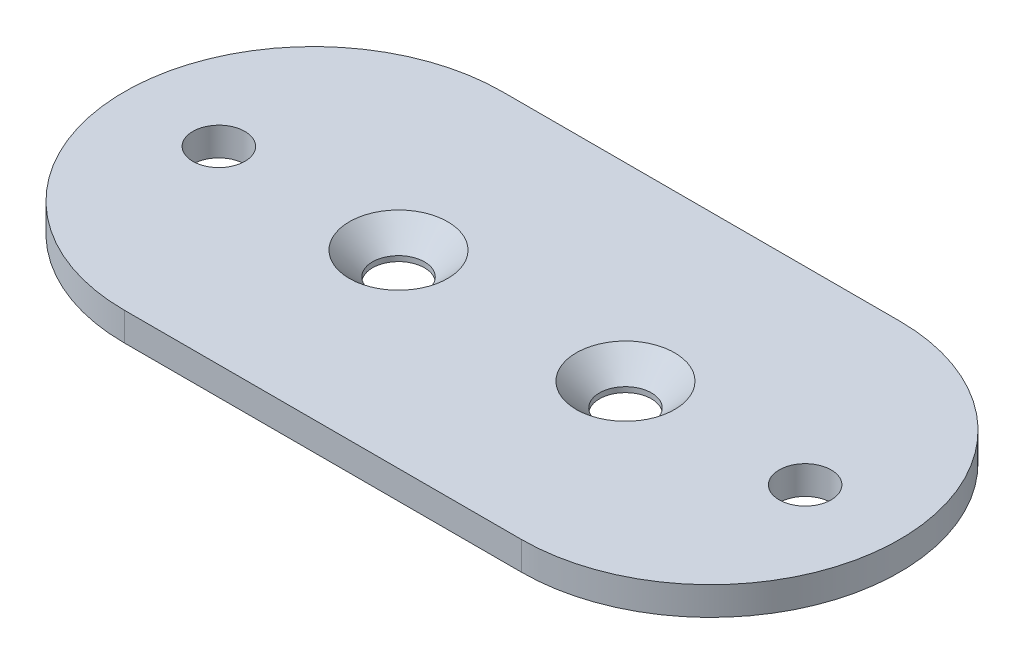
SolidWorks part; units mm, degrees
ref_plane "Front Plane" through (0, 0, 0) normal (0, 0, 1) x (1, 0, 0)
ref_plane "Top Plane" through (0, 0, 0) normal (0, 1, 0) x (1, 0, 0)
ref_plane "Right Plane" through (0, 0, 0) normal (1, 0, 0) x (0, 0, -1)
sketch "Sketch1" plane through (0, 0, 0) normal (0, 1, 0) x (1, 0, 0)
  line L0 (0, 0) -> (42, 0) construction
  line L1 (0, 20) -> (42, 20)
  line L2 (0, -20) -> (42, -20)
  line L3 (0, 0) -> (-10, 0) construction
  line L4 (42, 0) -> (52, 0) construction
  line L5 (21, 20) -> (21, -20) construction
  arc A0 (0, 20) -> (0, -20) centre (0, 0) ccw
  arc A1 (42, -20) -> (42, 20) centre (42, 0) ccw
  circle A2 centre (-10, 0) radius 2.75
  circle A3 centre (52, 0) radius 2.75
  dimension "D1" = 40
  dimension "D3" = 5.5
  dimension "D4" = 31
  dimension "D5" = 31
  dimension "D2" = 42
extrude "Boss-Extrude1" add sketch "Sketch1" along normal blind 3
sketch "Sketch2" plane through (0, 3, 0) normal (0, 1, 0) x (1, 0, 0)
  line L0 (0, 0) -> (49.25, 0) construction
  line L1 (21, 20) -> (21, -20) construction
  line L2 (42, 20) -> (0, 20) construction
  line L3 (0, -20) -> (42, -20) construction
  circle A0 centre (52, 0) radius 2.75 construction
  point P6 (9, 0)
  point P7 (33, 0)
  dimension "D1" = 24
  dimension "D2" = 12
hole_wizard "CSK for M5 Countersunk Flat Head Screw1" positions "3DSketch1" profile "Sketch3" countersink size "M5" standard "ISO"
sketch3d "3DSketch1"
  point P0 (33, 3, 0)
  point P3 (9, 3, 0)
sketch "Sketch3" plane through (33, 3, 0) normal (1, 0, 0) x (0, 0, 1)
  line L0 (0, 0) -> (0, 3)
  line L1 (0, 3) -> (2.75, 3)
  line L2 (2.75, 3) -> (2.75, 2.45)
  line L3 (2.75, 2.45) -> (5.2, 0)
  line L5 (5.2, 0) -> (0, 0)
  line L6 (-2.75, 2.45) -> (-5.2, 0) construction
  line L11 (0, -6.35) -> (0, 107.95) construction
  dimension "Thru Hole Dia." = 5.5
  dimension "Thru Hole Depth" = 3
  dimension "Near C'Sink Dia." = 10.4
  dimension "Near C'Sink Angle" = 90
